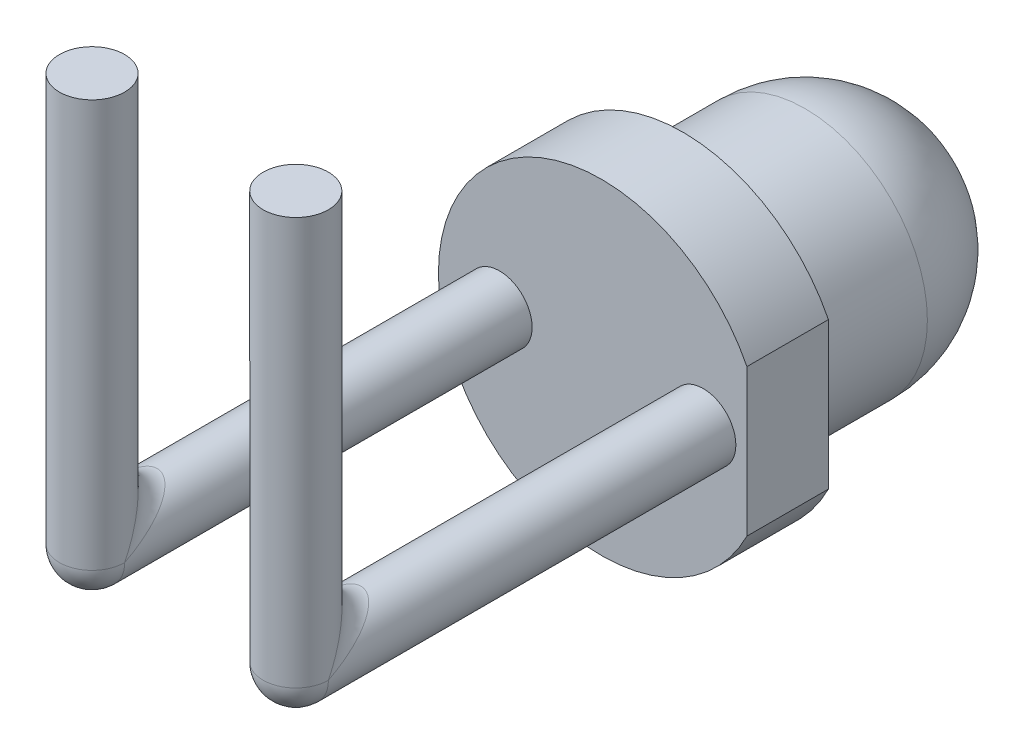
SolidWorks part; units mm, degrees
ref_plane "Face" through (0, 0, 0) normal (0, 0, 1) x (1, 0, 0)
ref_plane "Dessus" through (0, 0, 0) normal (0, 1, 0) x (1, 0, 0)
ref_plane "Droite" through (0, 0, 0) normal (1, 0, 0) x (0, 0, -1)
sketch "Esquisse1" plane through (0, 0, 0) normal (0, 0, 1) x (1, 0, 0)
  circle A0 centre (0, 0) radius 1.5
  dimension "D1" = 3
extrude "Base-Extrusion" add sketch "Esquisse1" along normal blind 4
sketch "Esquisse2" plane through (0, 0, 4) normal (0, 0, 1) x (1, 0, 0)
  line L0 (1.7857, -2.4917) -> (1.7857, 2.5621) construction
  line L1 (1.7857, 0.9007) -> (1.7857, -0.9007)
  arc A0 (1.7857, 0.9007) -> (1.7857, -0.9007) centre (0, 0) ccw
  dimension "D1" = 2
extrude "Boss.-Extru.1" add sketch "Esquisse2" against normal blind 1
fillet "Congé1" radius 1.5 1 edges at (1.5, 0, 0)
sketch "Esquisse3" plane through (0, 0, 4) normal (0, 0, 1) x (1, 0, 0)
  line L0 (0, 1.3283) -> (0, -0.9758) construction
  circle A0 centre (-1.25, 0) radius 0.4
  circle A1 centre (1.25, 0) radius 0.4
  dimension "D1" = 0.8
  dimension "D2" = 2.5
ref_plane "Plan2" through (0, 0, 0) normal (1, 0, 0) x (0, 0, -1)
sketch "Esquisse5" plane through (0, 0, 0) normal (1, 0, 0) x (0, 0, -1)
  line L0 (-4, 0) -> (-9, 0)
  line L1 (-9, 0) -> (-9, 5)
  line L2 (-4, 0.4) -> (-4, -0.4) construction
  dimension "D1" = 5
sweep "Balayage2" add profiles "Esquisse3" path "Esquisse5"
fillet "Congé2" radius 0.4 2 edges at (-1.25, 0.4, 8.6) (1.25, 0.4, 8.6)
